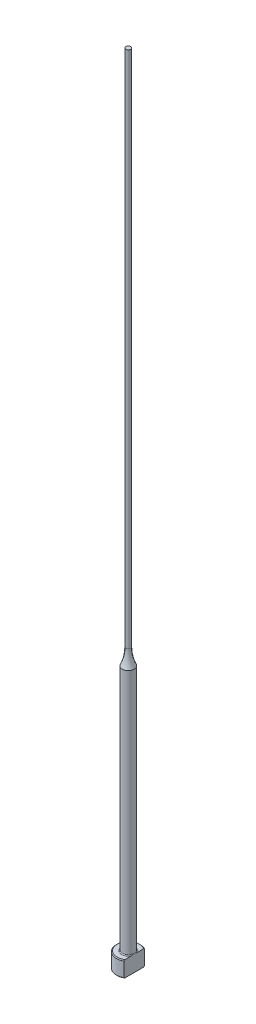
SolidWorks part; units mm, degrees
ref_plane "Front Plane" through (0, 0, 0) normal (0, 0, 1) x (1, 0, 0)
ref_plane "Top Plane" through (0, 0, 0) normal (0, 1, 0) x (1, 0, 0)
ref_plane "Right Plane" through (0, 0, 0) normal (1, 0, 0) x (0, 0, -1)
sketch "Sketch1" plane through (0, 0, 0) normal (0, 0, 1) x (1, 0, 0)
  line L0 (0, 259.9588) -> (0, -15.1925) construction
  line L1 (0, 0) -> (-3, 0)
  line L2 (-3, 0) -> (-3, 4)
  line L3 (-3, 4) -> (-1.5, 4)
  line L4 (-0.6, 70) -> (-0.6, 200)
  line L5 (-0.6, 200) -> (0, 200)
  line L6 (0, 200) -> (0, 0)
  line L7 (-1.5, 4) -> (-1.5, 65.8539)
  arc A0 (-1.5, 65.8539) -> (-0.6, 70) centre (-10.6, 70) ccw
  point P13 (-1.5, 0)
  dimension "D1" = 10
  dimension "L" = 200
  dimension "H" = 6
  dimension "T" = 4
  dimension "D" = 1.2
  dimension "B" = 3
  dimension "S" = 70
revolve "Revolve1" add sketch "Sketch1" angle 360 about L0
chamfer "Chamfer1" distance 0.2 angle 45 2 edges at (0, 4, 3) (0, 0, 3)
fillet "Fillet1" radius 0.2 1 edges at (0, 4, 1.5)
sketch "Sketch2" plane through (0, 0, 0) normal (0, 1, 0) x (1, 0, 0)
  line L0 (1.5, -2.5981) -> (1.5, 2.5981)
  circle A0 centre (0, 0) radius 3 construction
  arc A1 (1.5, -2.5981) -> (1.5, 2.5981) centre (0, 0) ccw
  circle A2 centre (0, 0) radius 1.5 construction
extrude "Keyed Head" cut sketch "Sketch2" along normal through all
